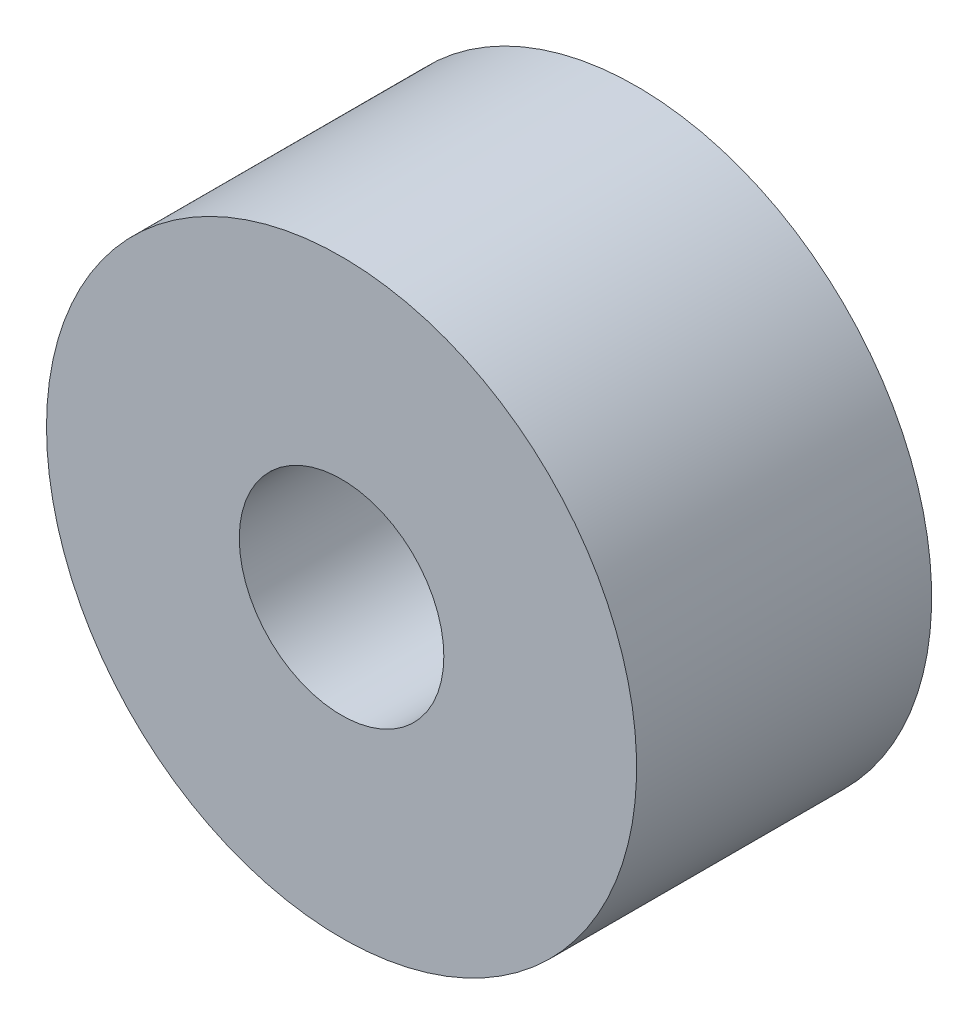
SolidWorks part; units mm, degrees
ref_plane "Plane1" through (0, 0, 0) normal (0, 0, 1) x (1, 0, 0)
ref_plane "Plane2" through (0, 0, 0) normal (0, 1, 0) x (1, 0, 0)
ref_plane "Plane3" through (0, 0, 0) normal (1, 0, 0) x (0, 0, -1)
sketch "Sketch1" plane through (0, 0, 0) normal (0, 0, 1) x (1, 0, 0)
  circle A0 centre (0, 0) radius 9.525
  circle A1 centre (0, 0) radius 3.302
  dimension "D1" = 19.05
  dimension "D2" = 6.604
extrude "Base-Extrude" add sketch "Sketch1" along normal blind 9.525
ref_plane "Plane4" through (9.525, 0, 0) normal (1, 0, 0) x (0, 0, -1)
